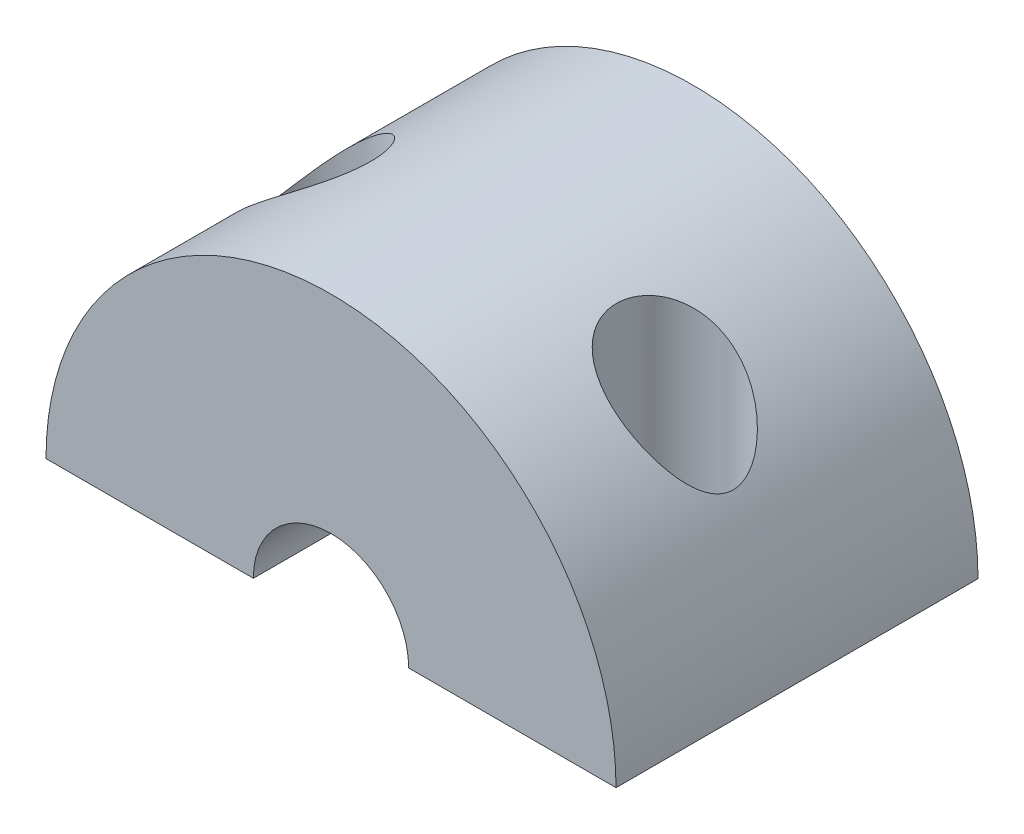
SolidWorks part; units mm, degrees
ref_plane "Front Plane" through (0, 0, 0) normal (0, 0, 1) x (1, 0, 0)
ref_plane "Top Plane" through (0, 0, 0) normal (0, 1, 0) x (1, 0, 0)
ref_plane "Right Plane" through (0, 0, 0) normal (1, 0, 0) x (0, 0, -1)
sketch "Sketch1" plane through (0, 0, 0) normal (0, 0, 1) x (1, 0, 0)
  line L0 (-173.2686, 0) -> (157.469, 0) construction
  line L1 (-10, 0) -> (-2.725, 0)
  line L2 (2.725, 0) -> (10, 0)
  arc A0 (2.725, 0) -> (-2.725, 0) centre (0, 0) ccw
  arc A1 (10, 0) -> (-10, 0) centre (0, 0) ccw
  dimension "D1" = 5.45
  dimension "D2" = 20
extrude "Boss-Extrude1" add sketch "Sketch1" along normal blind 12.7 contours A1 L1 A0 L2
sketch "Sketch2" plane through (0, 0, 0) normal (0, -1, 0) x (1, 0, 0)
  line L0 (0, 0) -> (0, 14.1186) construction
  line L1 (-10, 0) -> (-2.725, 0) construction
  circle A0 centre (-6.3625, 7) radius 2.05
  circle A1 centre (6.3625, 7) radius 2.05
  point P7 (-6.3625, 0)
  dimension "D1" = 4.1
  dimension "D2" = 7
extrude "Cut-Extrude1" cut sketch "Sketch2" against normal through all
